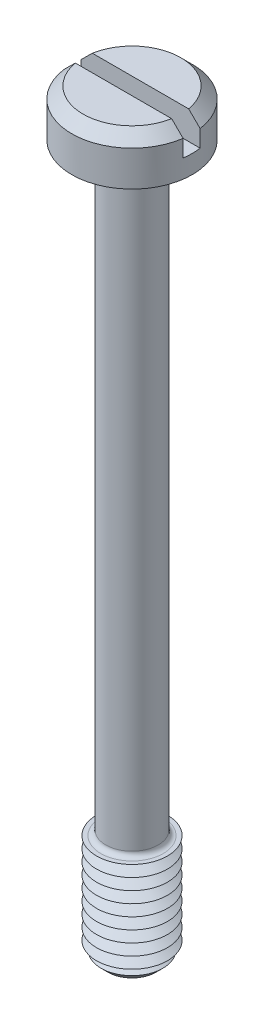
SolidWorks part; units mm, degrees
ref_plane "Front Plane" through (0, 0, 0) normal (0, 0, 1) x (1, 0, 0)
ref_plane "Top Plane" through (0, 0, 0) normal (0, 1, 0) x (1, 0, 0)
ref_plane "Right Plane" through (0, 0, 0) normal (1, 0, 0) x (0, 0, -1)
sketch "Sketch1" plane through (0, 0, 0) normal (0, 1, 0) x (1, 0, 0)
  circle A0 centre (0, 0) radius 4.25
  dimension "D1" = 8.5
extrude "Boss-Extrude1" add sketch "Sketch1" along normal blind 3.3
sketch "Sketch2" plane through (0, 0, 0) normal (0, -1, 0) x (1, 0, 0)
  circle A0 centre (0, 0) radius 1.85
  dimension "D1" = 3.7
extrude "Boss-Extrude2" add sketch "Sketch2" along normal blind 50
sketch "Sketch3" plane through (0, -50, 0) normal (0, -1, 0) x (1, 0, 0)
  circle A0 centre (0, 0) radius 2.5
  dimension "D1" = 5
extrude "Boss-Extrude3" add sketch "Sketch3" against normal blind 7.5
chamfer "Chamfer1" distance 0.8 angle 45 1 edges at (0, -50, -2.5)
sketch "Sketch4" plane through (0, 0, 0) normal (1, 0, 0) x (0, 0, -1)
  line L0 (0, -6.5871) -> (0, -12.0372) construction
sketch "Sketch5" plane through (0, 0, 0) normal (1, 0, 0) x (0, 0, -1)
  line L0 (-2.5, -42.5) -> (-1.8072, -42.9)
  line L1 (-1.8072, -42.9) -> (-2.5, -43.3)
  line L2 (-2.5, -42.5) -> (-2.5, -49.2) construction
  line L3 (-2.5, -43.3) -> (-2.5, -42.5)
  dimension "D1" = 0.8
revolve "Cut-Revolve1" cut sketch "Sketch5" angle 360 about L0
pattern_linear "LPattern1" count 9 spacing 0.8 along (0, -1, 0) of "Cut-Revolve1"
fillet "Fillet1" radius 0.35 2 edges at (0, -42.5, -1.85) (0, 0, -1.85)
chamfer "Chamfer2" distance 0.8 angle 45 1 edges at (0, 3.3, 4.25)
sketch "Sketch6" plane through (0, 3.3, 0) normal (0, 1, 0) x (1, 0, 0)
  line L1 (4.25, -0.6) -> (-4.25, -0.6)
  line L2 (4.25, -0.6) -> (4.25, 0.6)
  line L3 (4.25, 0.6) -> (-4.25, 0.6)
  line L4 (-4.25, -0.6) -> (-4.25, 0.6)
  line L5 (4.25, -0.6) -> (-4.25, 0.6) construction
  line L6 (4.25, 0.6) -> (-4.25, -0.6) construction
  circle A0 centre (0, 0) radius 4.25 construction
  point P0 (0, 0)
  dimension "D1" = 1.2
extrude "Cut-Extrude1" cut sketch "Sketch6" against normal blind 2
